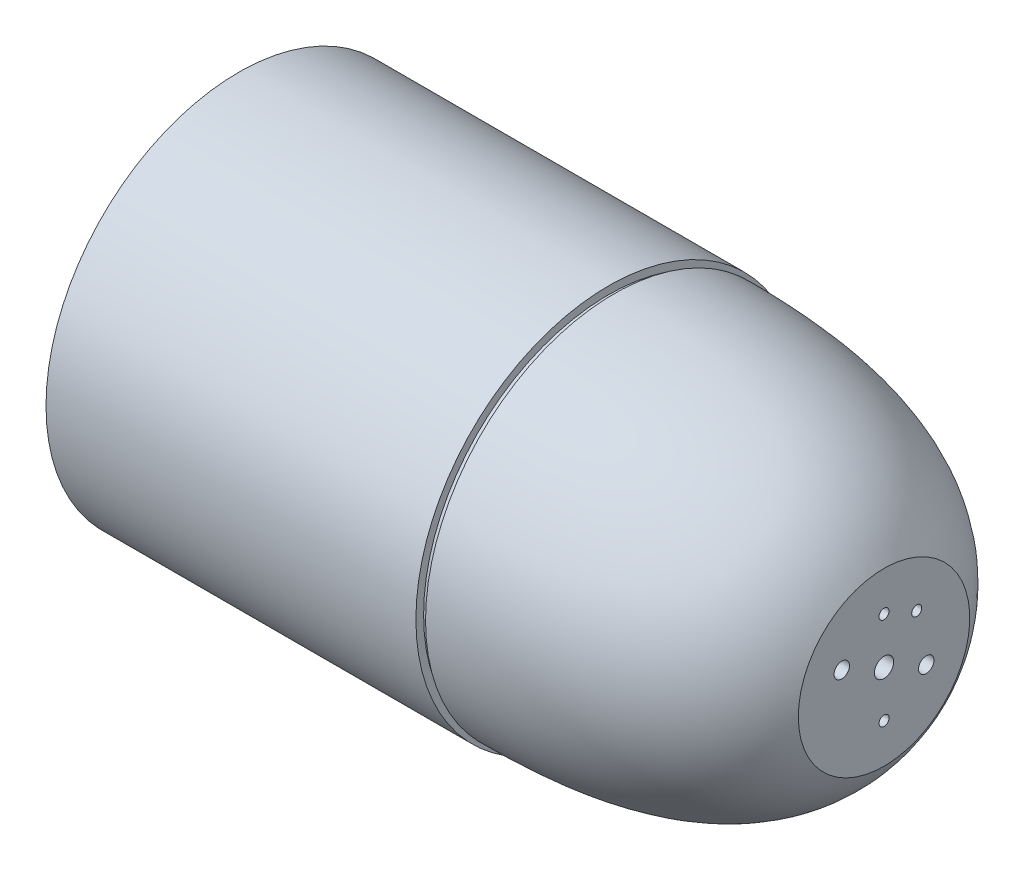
SolidWorks part; units mm, degrees
ref_plane "Plan de face" through (0, 0, 0) normal (0, 0, 1) x (1, 0, 0)
ref_plane "Plan de dessus" through (0, 0, 0) normal (0, 1, 0) x (1, 0, 0)
ref_plane "Plan de droite" through (0, 0, 0) normal (1, 0, 0) x (0, 0, -1)
sketch "Esquisse1" plane through (0, 0, 0) normal (0, 0, 1) x (1, 0, 0)
  line L0 (-4.5426, 0) -> (690.2142, 0) construction
  line L1 (30.6, 95) -> (3, 95)
  line L2 (37, 85.5) -> (45, 85.5)
  line L3 (0, 96.5) -> (0, 100)
  line L4 (0, 100) -> (192, 100)
  line L5 (326, 160.9552) -> (326, -42.125) construction
  line L6 (180, 93.6) -> (184.6, 89)
  line L7 (326, 0) -> (326, 42)
  line L8 (192, 72.635) -> (192, 125.5146) construction
  line L9 (335, 0) -> (335, 44.4943)
  line L10 (326, 0) -> (335, 0)
  line L11 (192, 96) -> (192, 100)
  line L12 (37, 93.6) -> (32, 93.6)
  line L13 (32, 93.6) -> (30.6, 95)
  line L14 (3, 95) -> (3, 95.5)
  line L15 (37, 93.6) -> (37, 85.5)
  line L16 (45, 93.6) -> (45, 85.5)
  line L17 (184.6, 89) -> (192, 89)
  line L18 (45, 93.6) -> (180, 93.6)
  line L19 (2, 96.5) -> (0, 96.5)
  line L20 (192, 96) -> (195, 96)
  line L21 (195, 96) -> (195, 97.9954)
  arc A0 (3, 95.5) -> (2, 96.5) centre (2, 95.5) ccw
  spline S0 degree 3 poles (192, 89) (231.9878, 89) (299.1046, 86.7944) (326, 42) knots 0 0 0 0 1 1 1 1
  spline S1 degree 1 poles (192, 98) (335, 44.4943) knots 0 0 1 1 construction
  spline S2 degree 3 poles (335, 44.4943) (334.7865, 44.8499) (334.4682, 45.3803) (334.0364, 46.0991) (333.7308, 46.6091) (333.3556, 47.2297) (332.8715, 48.0125) (331.9991, 49.3851) (330.7162, 51.2924) (328.5744, 54.2557) (325.7423, 57.7829) (320.905, 63.0587) (314.3364, 68.9747) (302.9199, 77.0765) (287.3093, 84.85) (267.377, 91.1248) (250.4349, 94.3621) (237.0715, 96.0519) (227.2422, 96.9383) (217.7058, 97.5116) (210.0872, 97.7834) (204.2417, 97.9099) (199.9944, 97.9674) (196.5843, 97.9908) (193.9316, 97.9989) (192.6474, 98) (192, 98) knots 0 0 0 0 0.007937 0.011905 0.015874 0.019842 0.02381 0.031747 0.047621 0.063495 0.095242 0.126989 0.190484 0.253978 0.380968 0.507957 0.634946 0.69844 0.761935 0.82543 0.888924 0.920671 0.952419 0.984166 1.00004 1.015913 1.015913 1.015913 1.015913 only from (335, 44.4943) to (195, 97.9954)
  dimension "D10" = 1
  dimension "D2" = 192
  dimension "D3" = 85.5
  dimension "D4" = 146
  dimension "D5" = 180
  dimension "D6" = 42
  dimension "D7" = 9
  dimension "D8" = 3
  dimension "D9" = 1.5
  dimension "D11" = 45
  dimension "D12" = 5
  dimension "D13" = 93.6
  dimension "D14" = 37
  dimension "D15" = 8
  dimension "D16" = 95
  dimension "D17" = 100
  dimension "D18" = 89
  dimension "D19" = 4
  dimension "D20" = 3
revolve "Révolution1" add sketch "Esquisse1" angle 360 about L0
sketch "Esquisse2" plane through (326, 0, 0) normal (-1, 0, 0) x (0, 0, 1)
  line L0 (-18.3039, 0) -> (48.9253, 0) construction
  line L1 (21.9251, 9.7617) -> (0, 0) construction
  line L2 (0, 0) -> (-16.9706, 16.9706) construction
  circle A0 centre (0, 0) radius 5
  circle A1 centre (21.9251, 9.7617) radius 4
  circle A2 centre (-21.9251, -9.7617) radius 4
  circle A3 centre (0, 24) radius 2.6
  circle A4 centre (-16.9706, 16.9706) radius 2.6
  circle A5 centre (0, -24) radius 2.6
  dimension "D3" = 8
  dimension "D4" = 10
  dimension "D7" = 5.2
  dimension "D1" = 24
  dimension "D2" = 24
  dimension "D5" = 24
  dimension "D6" = 24
  dimension "D8" = 24
  dimension "D9" = 45
  dimension "D10" = 24
extrude "Enlèv. mat.-Extru.1" cut sketch "Esquisse2" against normal through all
sketch "Esquisse3" plane through (37, 0, 0) normal (-1, 0, 0) x (0, 0, 1)
  circle A0 centre (0, -89) radius 2.25
  circle A1 centre (0, -89) radius 3.5 construction
  dimension "D2" = 4.5
  dimension "D3" = 7
  dimension "D1" = 89
extrude "Enlèv. mat.-Extru.2" cut sketch "Esquisse3" against normal blind 10
pattern_circular "Répétition circulaire1" count 8 over 360 about axis through (0, 0, 0) along (1, 0, 0) of "Enlèv. mat.-Extru.2"
sketch "Esquisse4" plane through (37, 0, 0) normal (-1, 0, 0) x (0, 0, 1)
  line L1 (-5, -85) -> (5, -85) construction
  line L2 (-5, -85) -> (-5, -93) construction
  line L3 (-5, -93) -> (5, -93) construction
  line L4 (5, -85) -> (5, -93) construction
  circle A1 centre (0, -89) radius 3.5 construction
  dimension "D1" = 7
  dimension "D2" = 10
  dimension "D3" = 8
  dimension "D4" = 5
  dimension "D5" = 4
sketch "Esquisse5" plane through (0, 0, 0) normal (1, 0, 0) x (0, 0, -1)
  line L0 (0, 107.1384) -> (118.2022, 107.1384)
  line L1 (0, 0) -> (-105.6606, 0)
  line L2 (0, 0) -> (0, 107.1384)
  line L3 (0, 107.1384) -> (-105.6606, 107.1384)
  line L4 (-105.6606, 0) -> (-105.6606, 107.1384)
  line L5 (118.2022, 107.1384) -> (118.2022, 0)
  line L6 (118.2022, 0) -> (0, 0)
  line L7 (0, 0) -> (0, -115.1131)
  line L8 (0, -115.1131) -> (118.2022, -115.1131)
  line L9 (118.2022, -115.1131) -> (118.2022, 0)
extrude "Enlèv. mat.-Extru.3" [suppressed] cut sketch "Esquisse5" along normal through all contours L6 L5 L0 L2 | L8 L9 L6 L7
